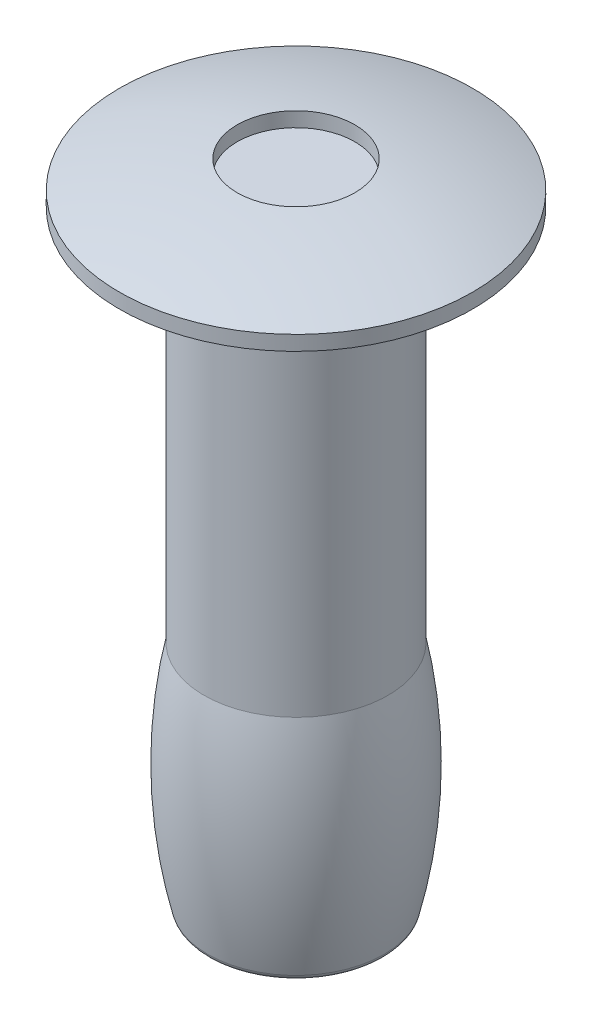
SolidWorks part; units mm, degrees
ref_plane "Front Plane" through (0, 0, 0) normal (0, 0, 1) x (1, 0, 0)
ref_plane "Top Plane" through (0, 0, 0) normal (0, 1, 0) x (1, 0, 0)
ref_plane "Right Plane" through (0, 0, 0) normal (1, 0, 0) x (0, 0, -1)
sketch "Sketch1" plane through (0, 0, 0) normal (0, 0, 1) x (1, 0, 0)
  line L0 (3.048, 5.708) -> (3.048, 5.454)
  line L1 (3.048, 5.454) -> (1.5875, 5.454)
  line L2 (1.5875, 5.454) -> (1.5875, -1.0484)
  line L3 (1.27, -4.1599) -> (1.27, -4.9219)
  line L4 (0, 6.2348) -> (0, -4.8584) construction
  line L5 (1.016, 6.1778) -> (1.016, 5.9238)
  line L6 (1.016, 5.9238) -> (0, 5.9238)
  line L7 (0, -4.8584) -> (0, 5.9238)
  arc A0 (1.016, 6.1778) -> (3.048, 5.708) centre (0, -2.8462) cw
  arc A1 (1.5875, -1.0484) -> (1.5204, -4.9519) centre (-7.1178, -2.8511) cw
  arc A2 (1.5204, -4.9519) -> (1.27, -4.9219) centre (1.397, -4.9219) cw
  arc A3 (0, -4.8584) -> (1.27, -4.1599) centre (0, -3.3546) ccw
  arc A4 (0, 6.2348) -> (1.016, 6.1778) centre (0, -2.8462) cw construction
  dimension "D1" = 3.175
  dimension "D5" = 0.127
  dimension "D9" = 8.89
  dimension "D2" = 6.5024
  dimension "D3" = 3.048
  dimension "D4" = 1.27
  dimension "D6" = 1.016
  dimension "D7" = 0.254
  dimension "D8" = 3.81
  dimension "D10" = 0.762
  dimension "D11" = 0.254
  dimension "D12" = 0.6985
revolve "Revolve1" add sketch "Sketch1" angle 360 about L4
